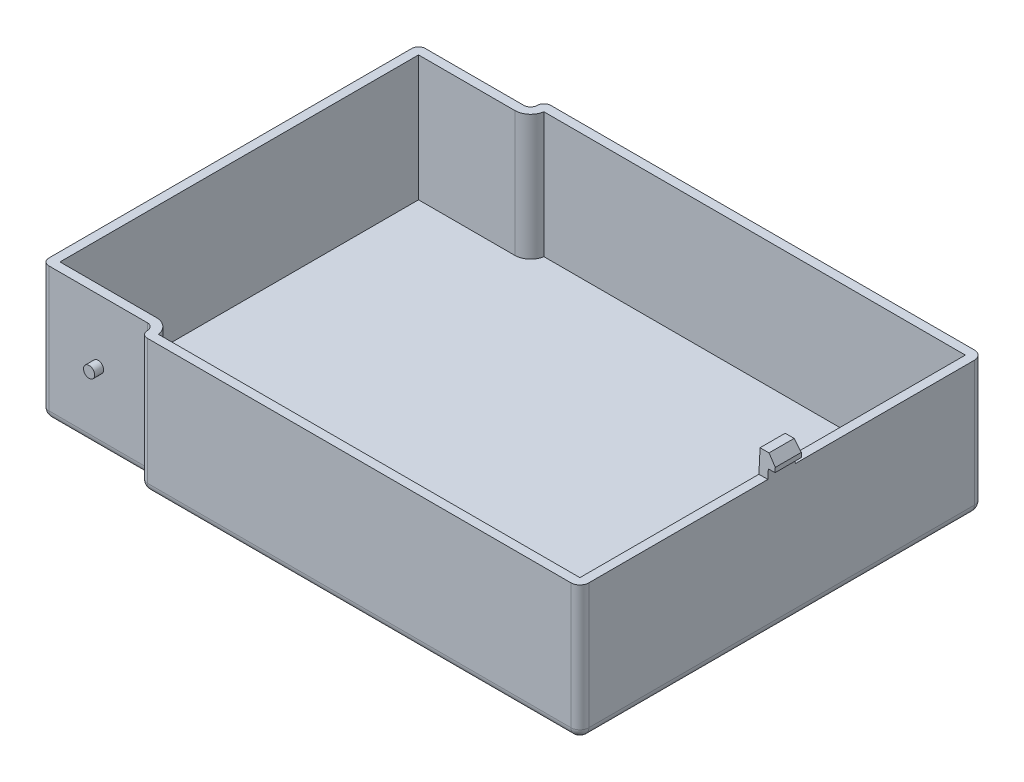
SolidWorks part; units mm, degrees
other "<Figure 11-54-2>-<Stock-Figure 11-59-1>"
ref_plane "Front Plane" through (0, 0, 0) normal (0, 0, 1) x (1, 0, 0)
ref_plane "Top Plane" through (0, 0, 0) normal (0, 1, 0) x (1, 0, 0)
ref_plane "Right Plane" through (0, 0, 0) normal (1, 0, 0) x (0, 0, -1)
sketch "Sketch1" plane through (0, 0, 0) normal (0, 1, 0) x (1, 0, 0)
  line L0 (-36.5, 45) -> (-36.5, 42)
  line L1 (-36.5, -45) -> (61.5, -45)
  line L2 (-61.5, -42) -> (-61.5, 42)
  line L3 (-36.5, 45) -> (61.5, 45)
  line L4 (61.5, -45) -> (61.5, 45)
  line L5 (-36.5, 42) -> (-61.5, 42)
  line L6 (-61.5, 0) -> (61.5, 0) construction
  line L8 (-36.5, -42) -> (-61.5, -42)
  line L9 (-36.5, -45) -> (-36.5, -42)
  dimension "D1" = 123
  dimension "D2" = 3
  dimension "D3" = 90
  dimension "D4" = 25
extrude "Extrude1" add sketch "Sketch1" along normal blind 30
fillet "Fillet1" radius 1.5 6 edges at (-36.5, 15, -45) (-36.5, 15, 45) (-36.5, 15, -42) (-61.5, 15, -42) (-61.5, 15, 42) (-36.5, 15, 42)
fillet "Fillet3" radius 2 2 edges at (61.5, 15, -45) (61.5, 15, 45)
fillet "Fillet2" radius 2 14 edges at (12.25, 0, -45) (-36.0607, 0, -44.5607) (-36.9393, 0, -42.4393) (-49, 0, -42) (-61.0607, 0, -41.5607) (-61.5, 0, 0) (-61.0607, 0, 41.5607) (-49, 0, 42) (-36.9393, 0, 42.4393) (-36.0607, 0, 44.5607) (61.5, 0, 0) (12.25, 0, 45) (60.9142, 0, -44.4142) (60.9142, 0, 44.4142)
shell "Shell1" thickness 2
sketch "Sketch2" plane through (0, 0, 42) normal (0, 0, 1) x (1, 0, 0)
  line L0 (-60, 30) -> (-38, 2) construction
  circle A0 centre (-49, 16) radius 1.25
  dimension "D1" = 2.5
extrude "Extrude2" add sketch "Sketch2" along normal blind 2
mirror "Mirror1" about plane through (0, 0, 0) normal (0, 0, 1) of "Extrude2"
sketch3d "3DSketch1"
  point P0 (61.5, 30, 0)
other "Snap Hook1" parameters "BaseDepth"=2, "TopDepth"=2, "Width"=5.6, "HookHeight"=3, "Overhang"=1.5, "BodyHeight"=2, "Draft"=3, "LipHeight"=1
inserted part "Figure 11-54-2"
